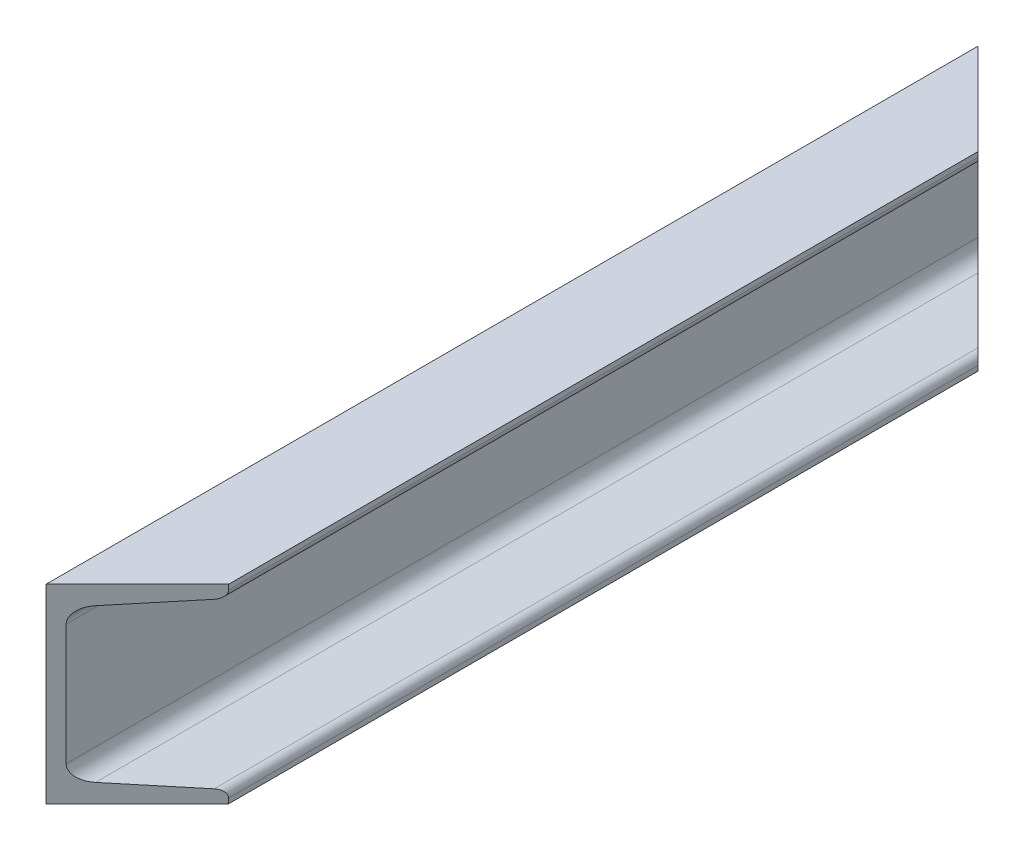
SolidWorks part; units mm, degrees
ref_plane "前视基准面" through (0, 0, 0) normal (0, 0, 1) x (1, 0, 0)
ref_plane "上视基准面" through (0, 0, 0) normal (0, 1, 0) x (1, 0, 0)
ref_plane "右视基准面" through (0, 0, 0) normal (1, 0, 0) x (0, 0, -1)
sketch "草图1" plane through (0, 0, 0) normal (0, 0, 1) x (1, 0, 0)
  line L0 (48, 50) -> (0, 50)
  line L1 (0, 50) -> (0, -50)
  line L2 (0, -50) -> (48, -50)
  line L3 (48, -50) -> (48, -47.3249)
  line L4 (44.1917, -43.1433) -> (13.0072, -40.222)
  line L5 (5.3, -31.759) -> (5.3, 31.759)
  line L6 (13.0072, 40.222) -> (44.1917, 43.1433)
  line L7 (48, 47.3249) -> (48, 50)
  line L8 (26.65, 50) -> (26.65, 41.5) construction
  line L9 (26.65, -41.5) -> (26.65, -50) construction
  arc A0 (5.3, 31.759) -> (13.0072, 40.222) centre (13.8, 31.759) cw
  arc A1 (13.0072, -40.222) -> (5.3, -31.759) centre (13.8, -31.759) cw
  arc A2 (44.1917, 43.1433) -> (48, 47.3249) centre (43.8, 47.3249) ccw
  arc A3 (48, -47.3249) -> (44.1917, -43.1433) centre (43.8, -47.3249) ccw
  point P19 (48, 43.5)
  point P22 (48, -43.5)
  dimension "D11" = 8.5
  dimension "D12" = 4.2
  dimension "D1" = 100
  dimension "D2" = 50
  dimension "D3" = 48
  dimension "D4" = 48
  dimension "D5" = 5.3
  dimension "D6" = 21.35
  dimension "D7" = 8.5
  dimension "D8" = 6.5
  dimension "D9" = 8.5
  dimension "D10" = 6.5
extrude "拉伸1" add sketch "草图1" along normal blind 490
sketch "草图2" plane through (0, 50, 0) normal (0, 1, 0) x (-1, 0, 0)
  line L0 (-48, 490) -> (-48, 442)
  line L1 (-48, 490) -> (-48, 0) construction
  line L2 (-48, 442) -> (0, 490)
  line L3 (0, 490) -> (-48, 490)
  line L4 (-48, 0) -> (-48, 48)
  line L5 (-48, 48) -> (0, 0)
  line L6 (0, 0) -> (-48, 0)
  dimension "D1" = 45
  dimension "D2" = 45
extrude "切除-拉伸1" cut sketch "草图2" against normal blind 490
